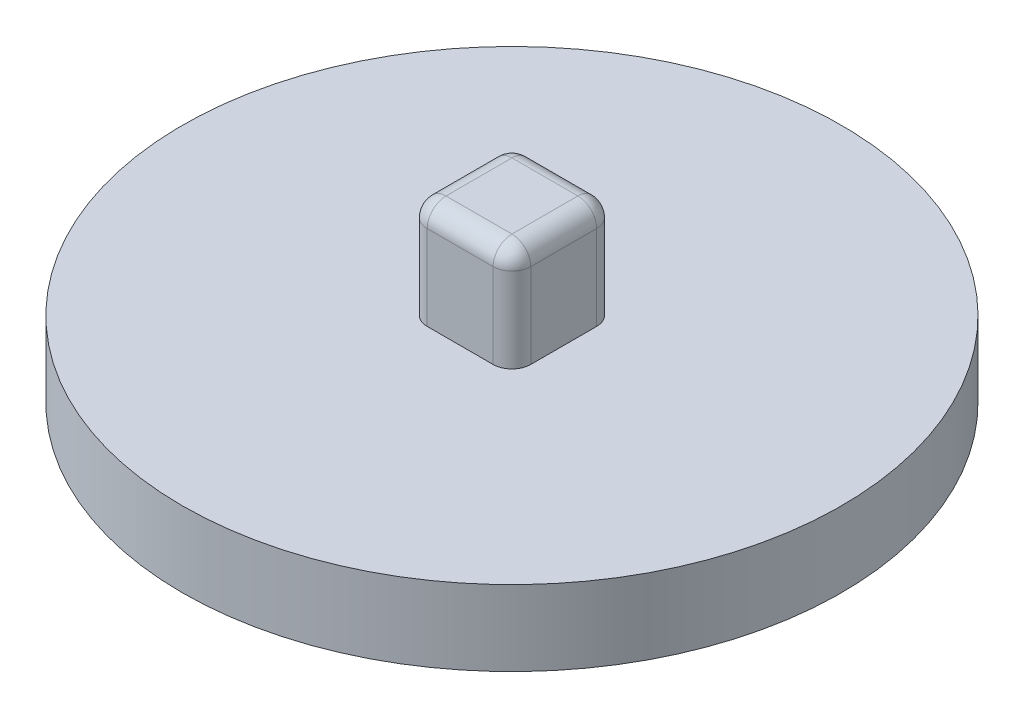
SolidWorks part; units mm, degrees
ref_plane "Front Plane" through (0, 0, 0) normal (0, 0, 1) x (1, 0, 0)
ref_plane "Top Plane" through (0, 0, 0) normal (0, 1, 0) x (1, 0, 0)
ref_plane "Right Plane" through (0, 0, 0) normal (1, 0, 0) x (0, 0, -1)
sketch "Sketch1" plane through (0, 0, 0) normal (0, 1, 0) x (1, 0, 0)
  circle A0 centre (0, 0) radius 35
  dimension "D1" = 70
extrude "Boss-Extrude1" add sketch "Sketch1" along normal blind 8
sketch "Sketch2" plane through (1.3553, 8, 0.4944) normal (0, 1, 0) x (1, 0, 0)
  line L1 (-6.8553, -5.0056) -> (4.1447, -5.0056)
  line L2 (-6.8553, -5.0056) -> (-6.8553, 5.9944)
  line L3 (-6.8553, 5.9944) -> (4.1447, 5.9944)
  line L4 (4.1447, -5.0056) -> (4.1447, 5.9944)
  line L5 (-6.8553, -5.0056) -> (4.1447, 5.9944) construction
  line L6 (-6.8553, 5.9944) -> (4.1447, -5.0056) construction
  point P0 (-1.3553, 0.4944)
  point P6 (0, 0.4944)
  point P7 (21.2052, 13.9333)
  point P8 (0, 0)
  point P9 (16.7488, -17.9578)
  point P10 (0, 0)
  point P11 (-49.6794, -5.9813)
  point P12 (0, 0)
  point P13 (0, 0)
  dimension "D1" = 11
  dimension "D2" = 11
extrude "Boss-Extrude2" add sketch "Sketch2" along normal blind 11
fillet "Fillet1" radius 2 8 edges at (0, 19, 5.5) (-5.5, 19, 0) (0, 19, -5.5) (5.5, 19, 0) (5.5, 13.5, -5.5) (-5.5, 13.5, -5.5) (-5.5, 13.5, 5.5) (5.5, 13.5, 5.5)
other "Fillet<1>"
